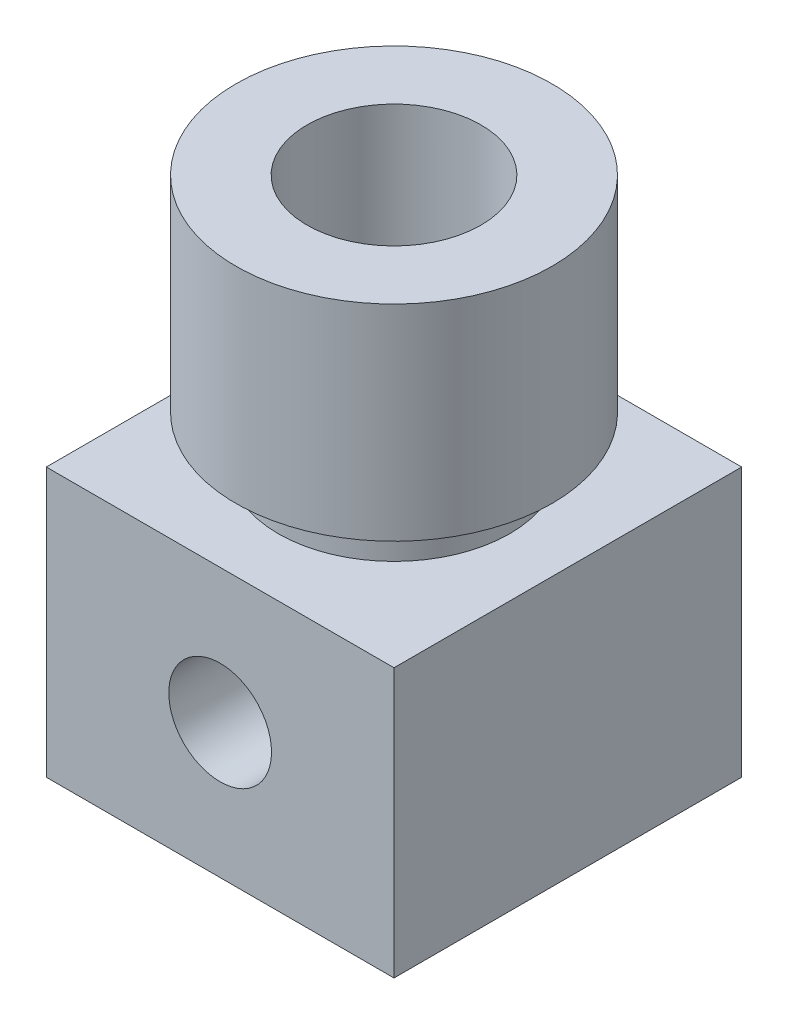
SolidWorks part; units mm, degrees
ref_plane "Front Plane" through (0, 0, 0) normal (0, 0, 1) x (1, 0, 0)
ref_plane "Top Plane" through (0, 0, 0) normal (0, 1, 0) x (1, 0, 0)
ref_plane "Right Plane" through (0, 0, 0) normal (1, 0, 0) x (0, 0, -1)
sketch "Sketch1" plane through (0, 0, 0) normal (0, 1, 0) x (1, 0, 0)
  line L1 (11, -11) -> (-11, -11)
  line L2 (11, -11) -> (11, 11)
  line L3 (11, 11) -> (-11, 11)
  line L4 (-11, -11) -> (-11, 11)
  line L5 (11, -11) -> (-11, 11) construction
  line L6 (11, 11) -> (-11, -11) construction
  circle A0 centre (0, 0) radius 5.5
  point P0 (0, 0)
  dimension "D3" = 11
  dimension "D1" = 22
  dimension "D2" = 22
extrude "Boss-Extrude1" add sketch "Sketch1" along normal blind 17
sketch "Sketch2" plane through (0, 0, 11) normal (0, 0, 1) x (1, 0, 0)
  circle A0 centre (0, 8.5) radius 3.25
  dimension "D1" = 6.5
  dimension "D2" = 8.5
extrude "Cut-Extrude1" cut sketch "Sketch2" against normal through all
sketch "Sketch3" plane through (0, 0, 0) normal (0, 0, 1) x (1, 0, 0)
  line L0 (0, 14.6311) -> (0, 33.6259) construction
  line L1 (-7.3181, 17) -> (-7.3181, 20)
  line L2 (-11, 17) -> (11, 17) construction
  line L4 (-7.3181, 20) -> (-10, 20)
  line L6 (-10, 20) -> (-10, 33)
  line L8 (-10, 33) -> (-5.5, 33)
  line L10 (-5.5, 33) -> (-5.5, 17)
  line L12 (-5.5, 17) -> (-7.3181, 17)
  point P7 (-6.409, 17)
  dimension "D1" = 16
  dimension "D2" = 3
  dimension "D3" = 11
  dimension "D4" = 20
revolve "Revolve1" add sketch "Sketch3" angle 360 about L0
